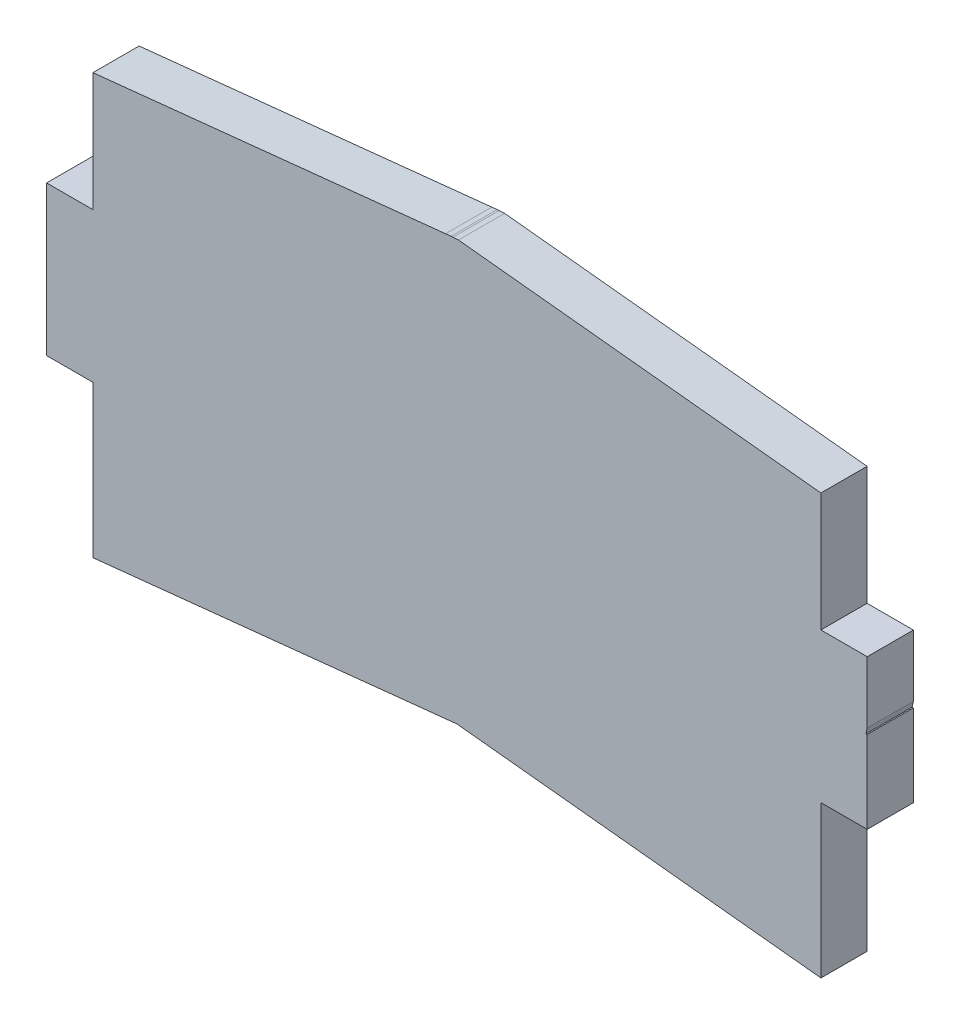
SolidWorks part; units mm, degrees
ref_plane "Alzado" through (0, 0, 0) normal (0, 0, 1) x (1, 0, 0)
ref_plane "Planta" through (0, 0, 0) normal (0, 1, 0) x (1, 0, 0)
ref_plane "Vista lateral" through (0, 0, 0) normal (1, 0, 0) x (0, 0, -1)
sketch "Croquis2" plane through (0, 0, 0) normal (0, 0, 1) x (1, 0, 0)
sketch_block_instance "F1 CAR CUT corte-1"
sketch_block "Bloque1"
extrude "Saliente-Extruir1" add sketch "Croquis2" along normal blind 3
delete or keep bodies "Sólido-Eliminar/Conservar 24" type delete bodies bodies 109 105 110 106 111 107
delete or keep bodies "Sólido-Eliminar/Conservar 25" type delete bodies bodies 113 114 103 112 104
delete or keep bodies "Sólido-Eliminar/Conservar 26" type delete bodies bodies 102 101
